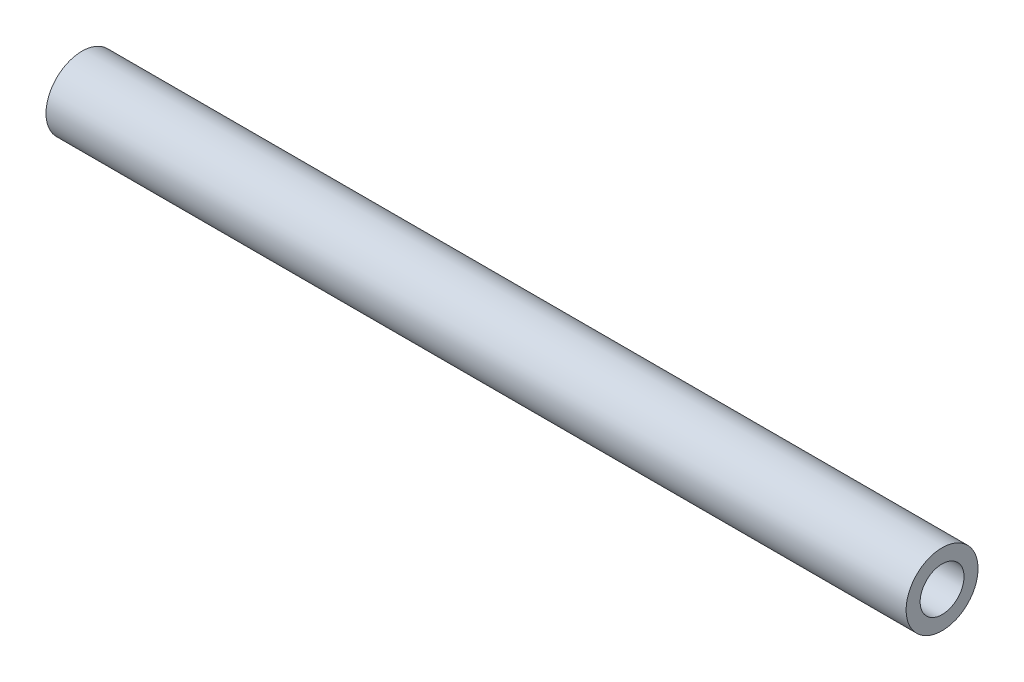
SolidWorks part; units mm, degrees
ref_plane "Front Plane" through (0, 0, 0) normal (0, 0, 1) x (1, 0, 0)
ref_plane "Top Plane" through (0, 0, 0) normal (0, 1, 0) x (1, 0, 0)
ref_plane "Right Plane" through (0, 0, 0) normal (1, 0, 0) x (0, 0, -1)
sketch "Sketch1" plane through (0, 0, 0) normal (1, 0, 0) x (0, 0, -1)
  circle A0 centre (0, 0) radius 3.05
  circle A1 centre (0, 0) radius 5
  dimension "D1" = 10
  dimension "D2" = 6.1
extrude "Boss-Extrude1" add sketch "Sketch1" along normal blind 119.5
